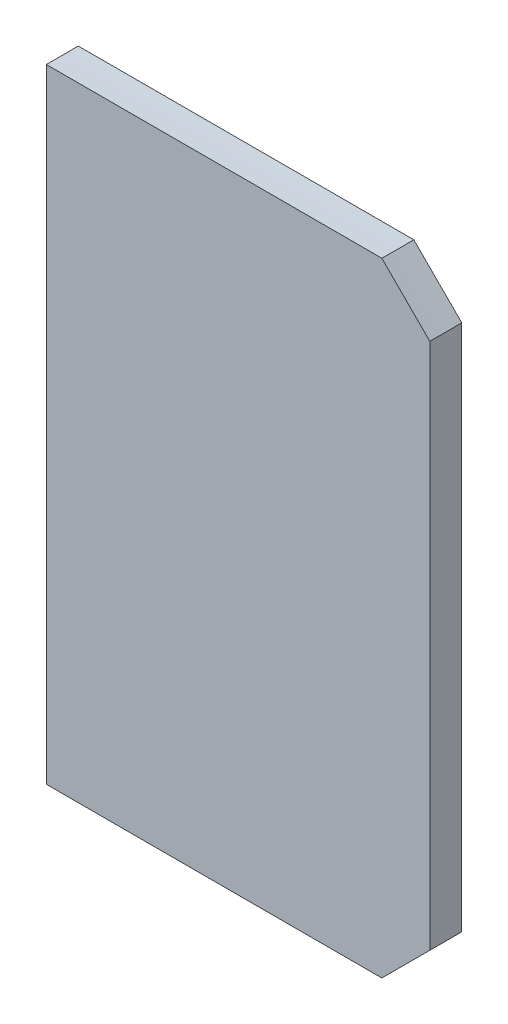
SolidWorks part; units mm, degrees
ref_plane "Plan de face" through (0, 0, 0) normal (0, 0, 1) x (1, 0, 0)
ref_plane "Plan de dessus" through (0, 0, 0) normal (0, 1, 0) x (1, 0, 0)
ref_plane "Plan de droite" through (0, 0, 0) normal (1, 0, 0) x (0, 0, -1)
sketch "Esquisse1" plane through (0, -510, 0) normal (0, 1, 0) x (1, 0, 0)
  line L1 (275, 5) -> (395, 5)
  line L2 (275, 5) -> (275, -5)
  line L3 (275, -5) -> (395, -5)
  line L4 (395, 5) -> (395, -5)
  line L5 (395, 280) -> (395, -280) construction
  dimension "D1" = 120
  dimension "D2" = 5
  dimension "D3" = 10
extrude "Extrusion1" add sketch "Esquisse1" along normal up to surface (195.0397 mm away)
chamfer "Chanfrein1" distance 15 angle 45 2 edges at (395, -315, 0) (395, -510, 0)
